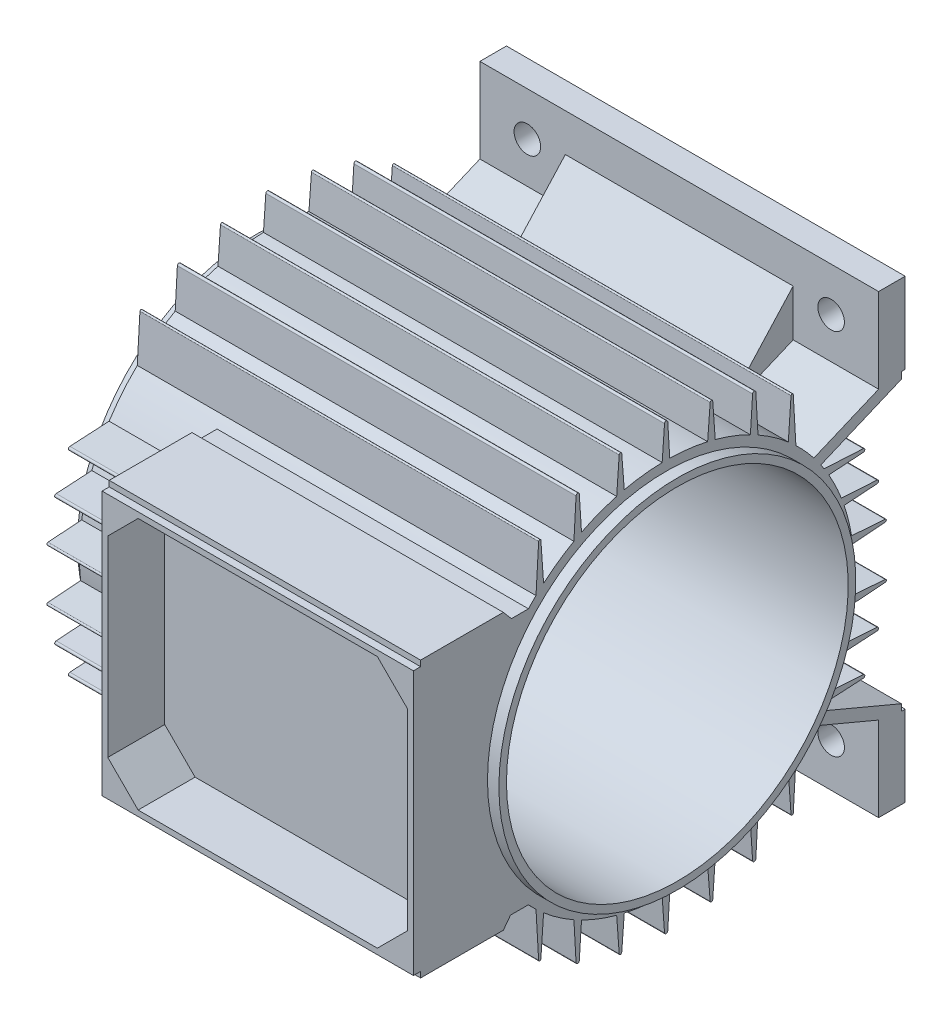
SolidWorks part; units mm, degrees
ref_plane "Plan de face" through (0, 0, 0) normal (0, 0, 1) x (1, 0, 0)
ref_plane "Plan de dessus" through (0, 0, 0) normal (0, 1, 0) x (1, 0, 0)
ref_plane "Plan de droite" through (0, 0, 0) normal (1, 0, 0) x (0, 0, -1)
imported_body "Importée1"
sketch "Esquisse1" plane through (0, 0, 66.5) normal (0, 0, 1) x (1, 0, 0)
  line L0 (-80.5, 25.25) -> (-72.5, 33.25)
  line L1 (-80.5, 33.25) -> (-80.5, -33.25) construction
  line L2 (-1.5, 33.25) -> (-80.5, 33.25) construction
  line L3 (-72.5, 33.25) -> (-80.5, 33.25)
  line L4 (-80.5, 33.25) -> (-80.5, 25.25)
  line L5 (0, 0) -> (-128.5353, 0) construction
  line L6 (-41, 75.7552) -> (-41, -45.5207) construction
  line L8 (0, -34.75) -> (0, 34.75) construction
  line L9 (-82, 34.75) -> (-82, -34.75) construction
  line L10 (-1.5, 33.25) -> (-1.5, 25.25)
  line L11 (-1.5, 25.25) -> (-9.5, 33.25)
  line L12 (-9.5, 33.25) -> (-1.5, 33.25)
  line L13 (-80.5, -33.25) -> (-80.5, -25.25)
  line L14 (-72.5, -33.25) -> (-80.5, -33.25)
  line L15 (-80.5, -25.25) -> (-72.5, -33.25)
  line L16 (-1.5, -33.25) -> (-1.5, -25.25)
  line L17 (-9.5, -33.25) -> (-1.5, -33.25)
  line L18 (-1.5, -25.25) -> (-9.5, -33.25)
  dimension "D1" = 8
  dimension "D2" = 8
extrude "Boss.-Extru.1" add sketch "Esquisse1" against normal up to surface (15 mm away)
